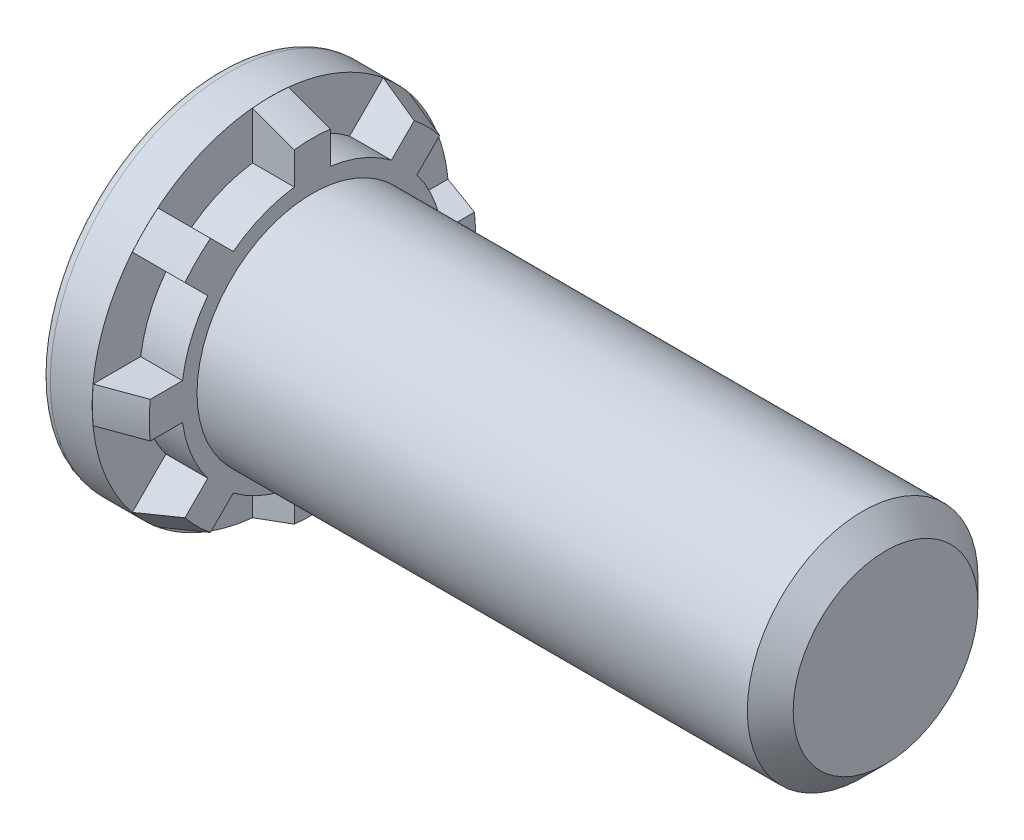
SolidWorks part; units mm, degrees
ref_plane "Plane1" through (0, 0, 0) normal (0, 0, 1) x (1, 0, 0)
ref_plane "Plane2" through (0, 0, 0) normal (0, 1, 0) x (1, 0, 0)
ref_plane "Plane3" through (0, 0, 0) normal (1, 0, 0) x (0, 0, -1)
sketch "BodySke" plane through (0, 0, 0) normal (0, 0, 1) x (1, 0, 0)
  line L0 (-2.159, 6.9342) -> (-2.159, 0)
  line L1 (1.7272, 6.7357) -> (1.7272, 4.7625)
  line L2 (0.0025, 7.3635) -> (1.7272, 6.7357)
  line L3 (1.7272, 4.7625) -> (24.4538, 4.7625)
  line L4 (25.4, 3.8163) -> (25.4, 0)
  line L5 (25.4, 0) -> (-2.159, 0)
  line L6 (0, 0) -> (50.554, 0) construction
  line L8 (25.4, 3.8163) -> (24.4538, 4.7625)
  line L9 (-1.7272, 7.366) -> (0, 7.366)
  line L10 (0.0025, 7.3635) -> (0, 7.3635)
  line L11 (1.5875, 19.05) -> (1.5875, -3.175) construction
  line L12 (0, 7.3635) -> (0, 7.366)
  arc A0 (-2.159, 6.9342) -> (-1.7272, 7.366) centre (-1.7272, 6.9342) cw
  dimension "D2" = 0.0025
  dimension "Fillet_rad" = 0.4318
  dimension "D1" = 20
  dimension "Diameter" = 9.525
  dimension "D3" = 0.0025
  dimension "Length" = 25.4
  dimension "Body_ch_ang" = 45
  dimension "Minor_dia" = 7.6327
  dimension "Advance" = 1.5875
  dimension "H_dia" = 14.732
  dimension "T_dim" = 2.159
  dimension "Clinch_ht" = 1.7272
revolve "BaseBody" add sketch "BodySke" angle 360 about L6
sketch "ThdSchSke" plane through (0, 0, 0) normal (0, 0, 1) x (1, 0, 0)
  line L0 (3.937, -3.8163) -> (3.2745, -4.7625)
  line L1 (3.937, -3.8163) -> (4.5995, -4.7625)
  line L2 (4.5995, -4.7625) -> (4.5995, -5.9531)
  line L3 (-3.175, 0) -> (5.1513, 0) construction
  line L4 (0, -7.366) -> (0, 7.366) construction
  line L5 (4.5995, -5.9531) -> (3.2745, -5.9531)
  line L6 (3.2745, -5.9531) -> (3.2745, -4.7625)
  dimension "Thread_minor" = 7.6327
  dimension "Diameter" = 9.525
  dimension "Start" = 3.937
  dimension "SideAngle" = 55
  dimension "VeeAngle" = 70
  dimension "Overcut" = 11.9063
revolve "ThreadSchematic" [suppressed] cut sketch "ThdSchSke" angle 360 about L3
pattern_linear "ThdSchPat" [suppressed]
sketch "RibCutSke" plane through (1.7272, 1.7944, -0.091) normal (1, 0, 0) x (0, 0, -1)
  line L0 (0.6541, 3.5675) -> (0.6541, 5.5338)
  line L1 (3.1736, 2.5238) -> (4.5641, 3.9142)
  line L2 (0.6541, 2.9095) -> (0.6541, 2.4006) construction
  line L3 (-0.091, -1.7944) -> (-0.091, 5.0239) construction
  line L4 (-0.091, -1.7944) -> (0.6541, 2.9095) construction
  line L5 (-0.091, -1.7944) -> (2.7084, 2.0585) construction
  line L6 (2.7084, 2.0585) -> (2.3536, 1.7038) construction
  arc A1 (3.1736, 2.5238) -> (0.6541, 3.5675) centre (-0.091, -1.7944) ccw
  arc A2 (4.5641, 3.9142) -> (0.6541, 5.5338) centre (-0.091, -1.7944) ccw
  circle A3 centre (-0.091, -1.7944) radius 6.7357 construction
  circle A4 centre (-0.091, -1.7944) radius 4.7625 construction
  dimension "Inner_dia" = 10.8267
  dimension "Outer_dia" = 14.732
  dimension "Rib_root_dia" = 9.525
  dimension "Rib_root_half_angle" = 9
  dimension "Rib_root_gap_angle" = 27
  dimension "Angle" = 45
extrude "RibCut" cut sketch "RibCutSke" against normal blind 1.7272
pattern_circular "RibCutsPat" count 8 every 45 about axis through (0, 0, 0) along (1, 0, 0) of "RibCut"
equation "' \"Length@BodySke\" = 1"
equation "' \"H_dia@BodySke\" = 0.58"
equation "' \"Start@ThdSchSke\" = 0.155"
equation "' \"T_dim@BodySke\" = 0.085"
equation "' \"Diameter@BodySke\" = 0.375"
equation "' \"Minor_dia@BodySke\" = 0.3005"
equation "' \"Advance@BodySke\" = 0.0625"
equation "\"Fillet_rad@BodySke\" =  \"T_dim@BodySke\" * 0.2"
equation "\"Clinch_ht@BodySke\" = \"T_dim@BodySke\" * 0.8"
equation "\"Num_ribs@RibCutsPat\" = 8"
equation "\"Angle@RibCutSke\" =\"Angle@RibCutsPat\""
equation "\"Rib_root_half_angle@RibCutSke\" = \"Angle@RibCutSke\" / 5"
equation "\"Rib_root_gap_angle@RibCutSke\" = \"Angle@RibCutSke\" - (2 * \"Rib_root_half_angle@RibCutSke\" )"
equation "\"Rib_root_dia@RibCutSke\" = \"Diameter@BodySke\""
equation "\"Inner_dia@RibCutSke\" = \"Diameter@BodySke\" + ( \"H_dia@BodySke\" - \"Diameter@BodySke\" ) / 4"
equation "\"Outer_dia@RibCutSke\" = \"H_dia@BodySke\""
equation "\"Depth@RibCut\" = \"Clinch_ht@BodySke\""
equation "\"Thread_length@ThreadCosmetic\" = \"Length@BodySke\" - \"Start@ThdSchSke\""
equation "\"Thread_minor@ThreadCosmetic\" = \"Minor_dia@BodySke\""
equation "\"Thread_minor@ThdSchSke\" = \"Minor_dia@BodySke\""
equation "\"Diameter@ThdSchSke\" = \"Diameter@BodySke\""
equation "\"Overcut@ThdSchSke\" = \"Diameter@BodySke\" * 1.25"
equation "\"Num_threads@ThdSchPat\" = int( \"Thread_length@ThreadCosmetic\" / \"Advance@BodySke\" + 0.999 )  + 1"
equation "\"Advance@ThdSchPat\" = \"Thread_length@ThreadCosmetic\" /  (\"Num_threads@ThdSchPat\" - 1) 'relax it"
equation "\"Num_threads@ThdSchPat\" = \"Num_threads@ThdSchPat\" - sgn( \"Num_threads@ThdSchPat\" - 1) '---chamfered tips only---"
